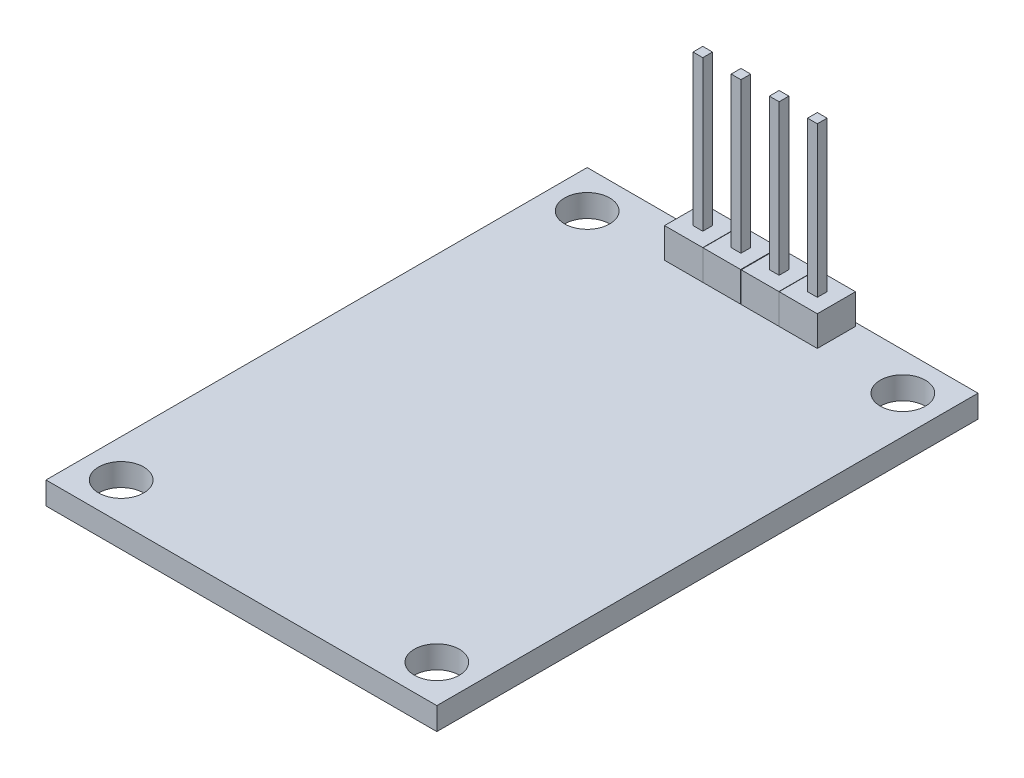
SolidWorks part; units mm, degrees
ref_plane "Ön Düzlem" through (0, 0, 0) normal (0, 0, 1) x (1, 0, 0)
ref_plane "Üst Düzlem" through (0, 0, 0) normal (0, 1, 0) x (1, 0, 0)
ref_plane "Sağ Düzlem" through (0, 0, 0) normal (1, 0, 0) x (0, 0, -1)
sketch "Sketch1" plane through (0, 0, 0) normal (0, 1, 0) x (1, 0, 0)
  line L1 (-13, 18) -> (13, 18)
  line L2 (-13, 18) -> (-13, -18)
  line L3 (-13, -18) -> (13, -18)
  line L4 (13, 18) -> (13, -18)
  line L5 (-13, 18) -> (13, -18) construction
  line L6 (-13, -18) -> (13, 18) construction
  point P0 (0, 0)
  dimension "D1" = 26
  dimension "D2" = 36
extrude "Boss-Extrude1" add sketch "Sketch1" along normal blind 1.5
sketch "Sketch2" plane through (0, 1.5, 0) normal (0, 1, 0) x (1, 0, 0)
  line L1 (-10.5, 15.5) -> (10.5, 15.5) construction
  line L2 (-10.5, 15.5) -> (-10.5, -15.5) construction
  line L3 (-10.5, -15.5) -> (10.5, -15.5) construction
  line L4 (10.5, 15.5) -> (10.5, -15.5) construction
  line L5 (-10.5, 15.5) -> (10.5, -15.5) construction
  line L6 (-10.5, -15.5) -> (10.5, 15.5) construction
  circle A0 centre (-10.5, 15.5) radius 1.5
  circle A1 centre (10.5, 15.5) radius 1.5
  circle A2 centre (10.5, -15.5) radius 1.5
  circle A3 centre (-10.5, -15.5) radius 1.5
  point P0 (0, 0)
  dimension "D3" = 3
  dimension "D4" = 3
  dimension "D5" = 3
  dimension "D6" = 3
  dimension "D1" = 31
  dimension "D2" = 21
extrude "Cut-Extrude1" cut sketch "Sketch2" against normal blind 1.5
sketch "Sketch3" plane through (0, 1.5, 0) normal (0, 1, 0) x (1, 0, 0)
  line L0 (-13, 16.5) -> (13, 16.5) construction
  line L1 (-13, 18) -> (-13, -18) construction
  line L2 (13, -18) -> (13, 18) construction
  line L3 (13, 18) -> (-13, 18) construction
  line L4 (0.02, 17.77) -> (2.52, 17.77)
  line L5 (0.02, 17.77) -> (0.02, 15.23)
  line L6 (0.02, 15.23) -> (2.52, 15.23)
  line L7 (2.52, 17.77) -> (2.52, 15.23)
  line L8 (0.02, 17.77) -> (2.52, 15.23) construction
  line L9 (0.02, 15.23) -> (2.52, 17.77) construction
  line L10 (0, 16.5) -> (0, 9.996) construction
  line L11 (-2.54, 15.23) -> (-5.08, 15.23)
  line L12 (2.54, 17.77) -> (5.08, 17.77)
  line L13 (2.54, 17.77) -> (2.54, 15.23)
  line L14 (2.54, 15.23) -> (5.08, 15.23)
  line L15 (5.08, 17.77) -> (5.08, 15.23)
  line L16 (2.54, 17.77) -> (5.08, 15.23) construction
  line L17 (2.54, 15.23) -> (5.08, 17.77) construction
  line L18 (-5.08, 17.77) -> (-5.08, 15.23)
  line L19 (-2.54, 17.77) -> (-5.08, 17.77)
  line L20 (-2.54, 17.77) -> (-2.54, 15.23)
  line L21 (-0.02, 15.23) -> (-2.52, 15.23)
  line L22 (-2.52, 17.77) -> (-2.52, 15.23)
  line L23 (-0.02, 17.77) -> (-2.52, 17.77)
  line L24 (-0.02, 17.77) -> (-0.02, 15.23)
  point P6 (1.27, 16.5)
  point P17 (3.81, 16.5)
  dimension "D1" = 2.5
  dimension "D2" = 2.54
  dimension "D3" = 1.5
  dimension "D4" = 1.27
  dimension "D5" = 2.54
  dimension "D6" = 2.54
  dimension "D7" = 2.54
extrude "Boss-Extrude2" add sketch "Sketch3" along normal blind 2
sketch "Sketch4" plane through (0, 3.5, 0) normal (0, 1, 0) x (1, 0, 0)
  line L0 (-5.08, 16.5) -> (-2.54, 16.5) construction
  line L1 (-5.08, 17.77) -> (-5.08, 15.23) construction
  line L2 (-2.54, 15.23) -> (-2.54, 17.77) construction
  line L3 (-2.54, 16.5) -> (-2.52, 16.5) construction
  line L4 (-2.52, 17.77) -> (-2.52, 15.23) construction
  line L5 (-2.52, 16.5) -> (-0.02, 16.5) construction
  line L6 (-0.02, 15.23) -> (-0.02, 17.77) construction
  line L7 (-0.02, 16.5) -> (0.02, 16.5) construction
  line L8 (0.02, 17.77) -> (0.02, 15.23) construction
  line L9 (0.02, 16.5) -> (2.52, 16.5) construction
  line L10 (2.52, 15.23) -> (2.52, 17.77) construction
  line L11 (2.52, 16.5) -> (2.54, 16.5) construction
  line L12 (2.54, 17.77) -> (2.54, 15.23) construction
  line L13 (2.54, 16.5) -> (5.08, 16.5) construction
  line L14 (5.08, 15.23) -> (5.08, 17.77) construction
  line L16 (-4.135, 16.825) -> (-3.485, 16.825)
  line L17 (-4.135, 16.825) -> (-4.135, 16.175)
  line L18 (-4.135, 16.175) -> (-3.485, 16.175)
  line L19 (-3.485, 16.825) -> (-3.485, 16.175)
  line L20 (-4.135, 16.825) -> (-3.485, 16.175) construction
  line L21 (-4.135, 16.175) -> (-3.485, 16.825) construction
  line L22 (-1.595, 16.825) -> (-0.945, 16.825)
  line L23 (-1.595, 16.825) -> (-1.595, 16.175)
  line L24 (-1.595, 16.175) -> (-0.945, 16.175)
  line L25 (-0.945, 16.825) -> (-0.945, 16.175)
  line L26 (-1.595, 16.825) -> (-0.945, 16.175) construction
  line L27 (-1.595, 16.175) -> (-0.945, 16.825) construction
  line L28 (0.945, 16.825) -> (1.595, 16.825)
  line L29 (0.945, 16.825) -> (0.945, 16.175)
  line L30 (0.945, 16.175) -> (1.595, 16.175)
  line L31 (1.595, 16.825) -> (1.595, 16.175)
  line L32 (0.945, 16.825) -> (1.595, 16.175) construction
  line L33 (0.945, 16.175) -> (1.595, 16.825) construction
  line L34 (3.485, 16.825) -> (4.135, 16.825)
  line L35 (3.485, 16.825) -> (3.485, 16.175)
  line L36 (3.485, 16.175) -> (4.135, 16.175)
  line L37 (4.135, 16.825) -> (4.135, 16.175)
  line L38 (3.485, 16.825) -> (4.135, 16.175) construction
  line L39 (3.485, 16.175) -> (4.135, 16.825) construction
  point P6 (-3.81, 16.5)
  point P29 (-1.27, 16.5)
  point P34 (1.27, 16.5)
  point P39 (3.81, 16.5)
  dimension "D1" = 0.65
  dimension "D2" = 0.65
  dimension "D3" = 0.65
  dimension "D4" = 0.65
  dimension "D5" = 0.65
  dimension "D6" = 0.65
  dimension "D7" = 0.65
  dimension "D8" = 0.65
extrude "Boss-Extrude3" add sketch "Sketch4" along normal blind 10 and the other way blind 5
sketch "Sketch5" plane through (0, 0, 0) normal (0, -1, 0) x (1, 0, 0)
  line L0 (-13, 18) -> (13, 18) construction
  line L1 (-7.5, 6.5) -> (7.5, 6.5)
  line L2 (-7.5, 6.5) -> (-7.5, -5)
  line L3 (-7.5, -5) -> (7.5, -5)
  line L4 (7.5, 6.5) -> (7.5, -5)
  line L5 (-7.5, 6.5) -> (7.5, -5) construction
  line L6 (-7.5, -5) -> (7.5, 6.5) construction
  point P0 (0, 0.75)
  point P7 (0, 0.75)
  dimension "D1" = 15
  dimension "D2" = 11.5
  dimension "D3" = 11.5
extrude "Boss-Extrude4" add sketch "Sketch5" along normal blind 2.5
sketch "Sketch6" plane through (0, 0, 0) normal (0, -1, 0) x (1, 0, 0)
  line L1 (0.162, -10.3844) -> (1.9956, -10.3844)
  line L2 (0.162, -10.3844) -> (0.162, -11.6747)
  line L3 (0.162, -11.6747) -> (1.9956, -11.6747)
  line L4 (1.9956, -10.3844) -> (1.9956, -11.6747)
  line L5 (0.162, -10.3844) -> (1.9956, -11.6747) construction
  line L6 (0.162, -11.6747) -> (1.9956, -10.3844) construction
  line L7 (2.4709, -10.3844) -> (4.4403, -10.3844)
  line L8 (2.4709, -10.3844) -> (2.4709, -11.6747)
  line L9 (2.4709, -11.6747) -> (4.4403, -11.6747)
  line L10 (4.4403, -10.3844) -> (4.4403, -11.6747)
  line L11 (2.4709, -10.3844) -> (4.4403, -11.6747) construction
  line L12 (2.4709, -11.6747) -> (4.4403, -10.3844) construction
  line L13 (4.9836, -10.3844) -> (6.6813, -10.3844)
  line L14 (4.9836, -10.3844) -> (4.9836, -11.6747)
  line L15 (4.9836, -11.6747) -> (6.6813, -11.6747)
  line L16 (6.6813, -10.3844) -> (6.6813, -11.6747)
  line L17 (4.9836, -10.3844) -> (6.6813, -11.6747) construction
  line L18 (4.9836, -11.6747) -> (6.6813, -10.3844) construction
  line L19 (7.2585, -10.3844) -> (8.8205, -10.3844)
  line L20 (7.2585, -10.3844) -> (7.2585, -11.6747)
  line L21 (7.2585, -11.6747) -> (8.8205, -11.6747)
  line L22 (8.8205, -10.3844) -> (8.8205, -11.6747)
  line L23 (7.2585, -10.3844) -> (8.8205, -11.6747) construction
  line L24 (7.2585, -11.6747) -> (8.8205, -10.3844) construction
  point P0 (1.0788, -11.0295)
  point P5 (3.4556, -11.0295)
  point P10 (5.8324, -11.0295)
  point P15 (8.0395, -11.0295)
extrude "Boss-Extrude5" add sketch "Sketch6" along normal blind 1.5
fillet "Fillet1" radius 0.5 4 edges at (0, -2.5, -5) (-7.5, -2.5, 0.75) (0, -2.5, 6.5) (7.5, -2.5, 0.75)
sketch "Sketch7" plane through (0, -2.5, 0) normal (0, -1, 0) x (1, 0, 0)
  line L0 (-4.6766, -1.8606) -> (5.1292, -1.8606) construction
  text T0 "GPS"
extrude "Cut-Extrude2" cut sketch "Sketch7" against normal blind 0.5
